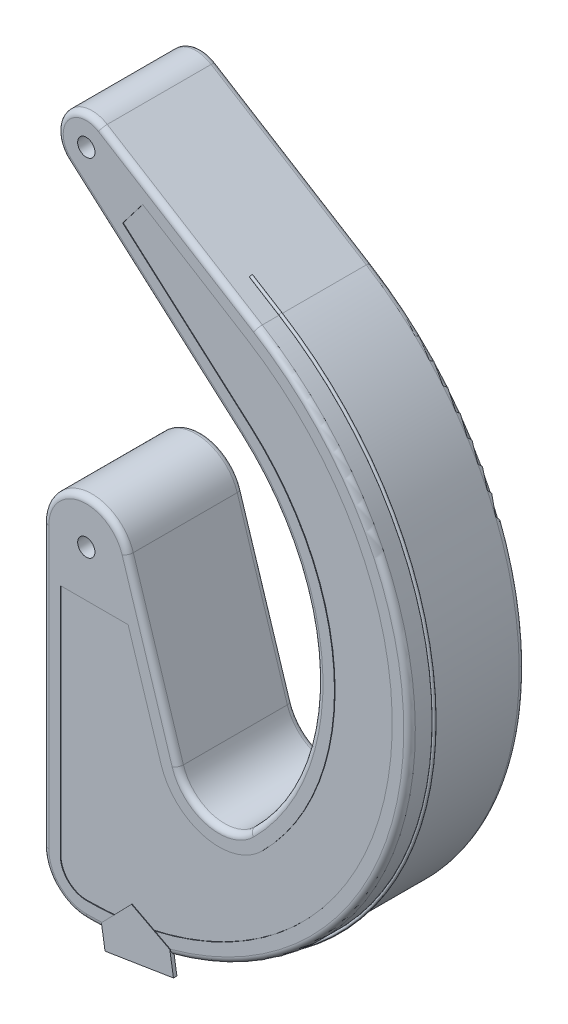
SolidWorks part; units mm, degrees
ref_plane "Plan de face" through (0, 0, 0) normal (0, 0, 1) x (1, 0, 0)
ref_plane "Plan de dessus" through (0, 0, 0) normal (0, 1, 0) x (1, 0, 0)
ref_plane "Plan de droite" through (0, 0, 0) normal (1, 0, 0) x (0, 0, -1)
sketch "Esquisse1" plane through (0, 0, 0) normal (0, 0, 1) x (1, 0, 0)
  line L0 (0, 0) -> (0, -47.5) construction
  line L1 (0, 0) -> (22.981, -22.981) construction
  line L2 (-7.5, 0) -> (-7.5, -48.5)
  line L3 (7.1523, 2.257) -> (15.8286, -25.238)
  line L4 (-3.3072, 56.25) -> (26.4575, 30)
  line L6 (2.6339, 64.25) -> (29.4998, 47.6)
  circle A0 centre (0, 60) radius 1.5
  arc A2 (7.1523, 2.257) -> (-7.5, 0) centre (0, 0) ccw
  arc A4 (15.8286, -25.238) -> (28.2843, -28.2843) centre (22.981, -22.981) ccw
  arc A5 (2.6339, 64.25) -> (-3.3072, 56.25) centre (0, 60) ccw
  arc A6 (28.2843, -28.2843) -> (26.4575, 30) centre (0, 0) ccw
  circle A7 centre (0, 0) radius 1.5
  arc A8 (0, -56) -> (29.4998, 47.6) centre (0, 0) ccw
  arc A10 (0, -56) -> (-7.5, -48.5) centre (0, -48.5) cw
  dimension "D2" = 15
  dimension "D3" = 56
  dimension "D4" = 15
  dimension "D5" = 10
  dimension "D7" = 3
  dimension "D8" = 3
  dimension "D10" = 7.5
  dimension "D11" = 40
  dimension "D6" = 45
  dimension "D9" = 32.5
extrude "Boss.-Extru.1" add sketch "Esquisse1" along normal mid plane 20
fillet "Congé1" radius 1 20 edges at (-7.5, -24.25, -10) (-1.1418, 7.4126, -10) (11.4905, -11.4905, -10) (21.1992, -30.2662, -10) (39.9804, 1.2531, -10) (-4.0141, 62.9811, -10) (11.5752, 43.125, -10) (-7.5, -24.25, 10) (-1.1418, 7.4126, 10) (11.4905, -11.4905, 10) (21.1992, -30.2662, 10) (39.9804, 1.2531, 10) (11.5752, 43.125, 10) (-4.0141, 62.9811, 10) (16.0669, 55.925, -10) (53.8591, -15.3362, -10) (-5.3033, -53.8033, -10) (16.0669, 55.925, 10) (53.8591, -15.3362, 10) (-5.3033, -53.8033, 10)
sketch "Esquisse2" plane through (0, 0, 10) normal (0, 0, 1) x (1, 0, 0)
  line L0 (14.5662, -53.0361) -> (15.1984, -56.9858)
  line L1 (15.1984, -56.9858) -> (3.3493, -58.8826)
  line L2 (3.3493, -58.8826) -> (2.717, -54.9328)
  line L3 (2.717, -54.9328) -> (7.9333, -49.56)
  line L4 (7.9333, -49.56) -> (14.5662, -53.0361)
  line L6 (0, 0) -> (9.2738, -57.9342) construction
  arc A1 (0, -55) -> (28.973, 46.75) centre (0, 0) ccw construction
  dimension "D2" = 6
  dimension "D3" = 4
extrude "Boss.-Extru.2" add sketch "Esquisse2" against normal blind 0.5 and the other way blind 0.1
sketch "Esquisse4" plane through (0, 0, -10) normal (0, 0, -1) x (-1, 0, 0)
  line L0 (-7.2432, -8) -> (4.5, -8)
  line L5 (-1.0536, 61.7) -> (-27.9195, 45.05)
  line L6 (-9.7625, 56.3027) -> (-27.9195, 45.05)
  line L8 (-6.2999, 51.7773) -> (-9.7625, 56.3027)
  line L9 (0, 60) -> (-7.9419, 53.9233) construction
  line L12 (4.5, -48.5) -> (4.5, 0)
  line L13 (-4.2914, 1.3542) -> (-12.9677, -26.1408)
  line L14 (-28.4418, 32.25) -> (1.3229, 58.5)
  line L16 (4.5, -48.5) -> (4.5, -8)
  line L17 (-7.2432, -8) -> (-12.9677, -26.1408)
  line L18 (-28.4418, 32.25) -> (-6.2999, 51.7773)
  arc A6 (-27.9195, 45.05) -> (0, -53) centre (0, 0) ccw
  arc A7 (-27.9195, 45.05) -> (0, -53) centre (0, 0) ccw
  arc A8 (0, -53) -> (4.5, -48.5) centre (0, -48.5) ccw
  arc A9 (0, -53) -> (4.5, -48.5) centre (0, -48.5) ccw
  arc A20 (4.5, 0) -> (-4.2914, 1.3542) centre (0, 0) ccw
  arc A21 (-30.4056, -30.4056) -> (-12.9677, -26.1408) centre (-22.981, -22.981) ccw
  arc A22 (-28.4418, 32.25) -> (-30.4056, -30.4056) centre (0, 0) ccw
  arc A23 (1.3229, 58.5) -> (-1.0536, 61.7) centre (0, 60) ccw
  arc A27 (-30.4056, -30.4056) -> (-12.9677, -26.1408) centre (-22.981, -22.981) ccw
  arc A28 (-28.4418, 32.25) -> (-30.4056, -30.4056) centre (0, 0) ccw
  dimension "D2" = 10
  dimension "D1" = 2
extrude "Enlèv. mat.-Extru.2" cut sketch "Esquisse4" against normal blind 0.1
mirror "Symétrie1" about plane through (0, 0, 0) normal (0, 0, 1) of "Enlèv. mat.-Extru.2"
sketch "Esquisse5" plane through (-7.5, 0, 0) normal (-1, 0, 0) x (0, 0, 1)
  line L0 (9, 0) -> (-9, 0) construction
  line L1 (-6, -43.5) -> (6, -43.5)
  line L2 (-6, -43.5) -> (-6, -5.5)
  line L3 (-6, -5.5) -> (6, -5.5)
  line L4 (6, -43.5) -> (6, -5.5)
  point P4 (0, 0)
  dimension "D1" = 6
  dimension "D2" = 12
  dimension "D3" = 5.5
  dimension "D4" = 38
extrude "Enlèv. mat.-Extru.3" cut sketch "Esquisse5" against normal blind 10
sketch "Esquisse6" plane through (0, 0, -6) normal (0, 0, 1) x (1, 0, 0)
  line L0 (2.5, -43.5) -> (-7.5, -43.5) construction
  line L1 (-7.5, -5.5) -> (-7.5, -43.5) construction
  circle A0 centre (-3.5, -39.5) radius 1
  dimension "D1" = 2
  dimension "D2" = 4
  dimension "D3" = 4
extrude "Boss.-Extru.3" add sketch "Esquisse6" along normal up to surface (12 mm away)
ref_plane "Plan1" through (-4, 0, 0) normal (-1, 0, 0) x (0, 0, 1)
sketch "Esquisse7" plane through (-4, 0, 0) normal (-1, 0, 0) x (0, 0, 1)
  line L0 (7.4765, -15.1329) -> (1, -18.8721)
  line L1 (-1, -18.8721) -> (-7.4765, -15.1329)
  line L2 (0, -34.925) -> (0, 34.925) construction
  line L3 (9, -22.981) -> (-9, -22.981) construction
  arc A1 (1, -18.8721) -> (-1, -18.8721) centre (0, -17.14) cw
  point P11 (-5.9762, -21.4854)
  dimension "D3" = 120
  dimension "D1" = 2
  dimension "D4" = 30
sketch "Esquisse9" plane through (0, 0, 0) normal (0, 0, 1) x (1, 0, 0)
  circle A0 centre (-4, -19.14) radius 0.25
  dimension "D1" = 0.5
sweep "Balayage1" add profiles "Esquisse9" path "Esquisse7"
mirror "Symétrie2" of "Balayage1"
sketch "Esquisse10" plane through (0, 0, 6) normal (0, 0, -1) x (-1, 0, 0)
  line L7 (-2.5, -43.5) -> (7.5, -43.5) construction
  line L8 (7.75, -48.5) -> (7.75, 0)
  line L10 (-2.7656, 64.4625) -> (-29.6315, 47.8125)
  line L11 (7.75, -48.5) -> (7.75, -43.5)
  line L12 (-24.5315, 50.9732) -> (-29.6315, 47.8125)
  arc A4 (0, -56.25) -> (7.75, -48.5) centre (0, -48.5) ccw
  arc A5 (-29.6315, 47.8125) -> (0, -56.25) centre (0, 0) ccw
  arc A6 (0, -56.25) -> (7.75, -48.5) centre (0, -48.5) ccw
  arc A7 (-29.6315, 47.8125) -> (0, -56.25) centre (0, 0) ccw
  dimension "D2" = 6
  dimension "D1" = 0.25
sketch "Esquisse11" plane through (0, -43.5, 0) normal (0, 1, 0) x (1, 0, 0)
  circle A0 centre (-7.75, -6) radius 0.25
  dimension "D1" = 0.5
  dimension "D2" = 0.5
ref_plane "Plan2" through (27.9195, 45.05, 0) normal (-0.5268, -0.85, 0) x (0.85, -0.5268, 0)
sweep "Balayage3" add profiles "Esquisse11" path "Esquisse10"
